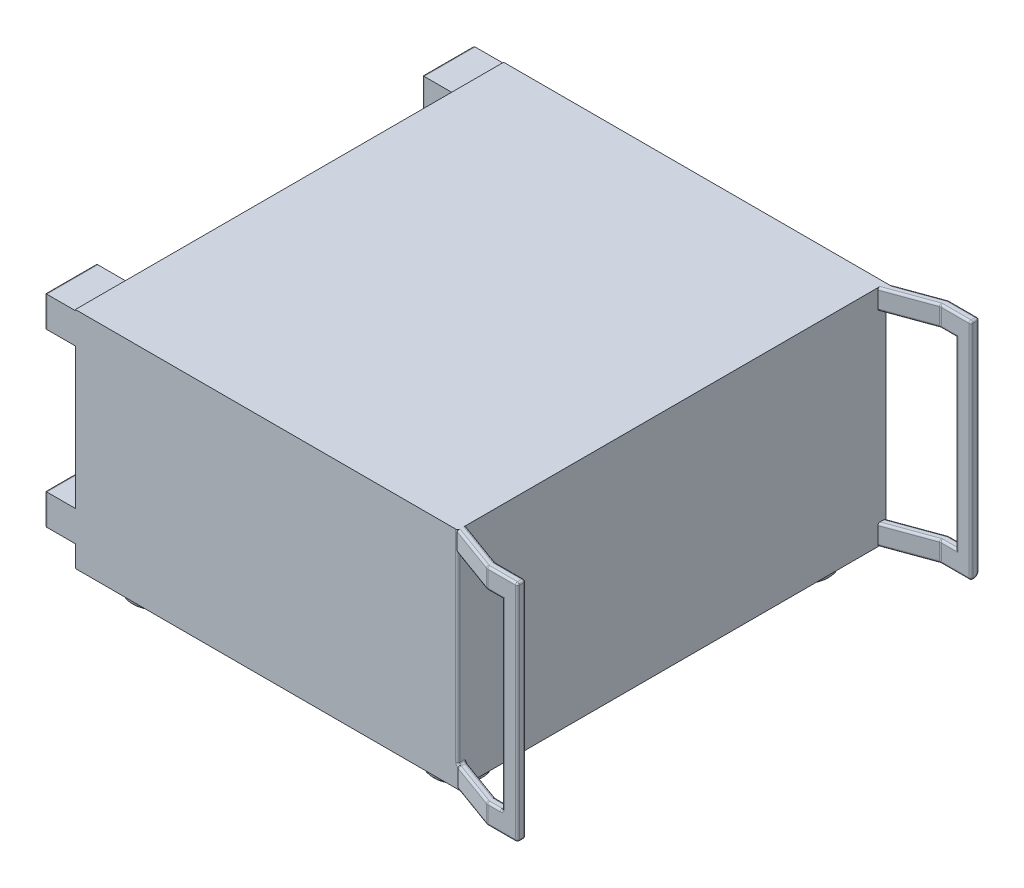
SolidWorks part; units mm, degrees
ref_plane "Front Plane" through (0, 0, 0) normal (0, 0, 1) x (1, 0, 0)
ref_plane "Top Plane" through (0, 0, 0) normal (0, 1, 0) x (1, 0, 0)
ref_plane "Right Plane" through (0, 0, 0) normal (1, 0, 0) x (0, 0, -1)
sketch "Sketch1" plane through (0, 0, 0) normal (0, 1, 0) x (1, 0, 0)
  line L1 (-187.5, -210) -> (187.5, -210)
  line L2 (-187.5, -210) -> (-187.5, 210)
  line L3 (-187.5, 210) -> (187.5, 210)
  line L4 (187.5, -210) -> (187.5, 210)
  line L5 (-187.5, -210) -> (187.5, 210) construction
  line L6 (-187.5, 210) -> (187.5, -210) construction
  point P0 (0, 0)
  dimension "D1" = 375
  dimension "D2" = 420
extrude "Boss-Extrude1" add sketch "Sketch1" along normal blind 220
sketch "Sketch8" plane through (0, 0, 0) normal (0, -1, 0) x (1, 0, 0)
  line L0 (-187.5, 210) -> (187.5, 210) construction
  line L2 (-187.5, -210) -> (-187.5, 210) construction
  circle A0 centre (-147.5, 170) radius 25
  dimension "D1" = 50
  dimension "D3" = 40
  dimension "D2" = 40
extrude "Boss-Extrude3" add sketch "Sketch8" along normal blind 20
mirror "Mirror3" about plane through (0, 0, 0) normal (1, 0, 0) of "Boss-Extrude3"
mirror "Mirror4" about plane through (0, 0, 0) normal (0, 0, 1) of "Mirror3", "Boss-Extrude3"
sketch "Sketch9" plane through (0, 220, 0) normal (0, 1, 0) x (1, 0, 0)
  line L0 (187.5, 210) -> (232.5, 226.3787)
  line L1 (232.5, 226.3787) -> (262.5, 226.3787)
  line L2 (262.5, 226.3787) -> (262.5, 218.3787)
  line L3 (262.5, 218.3787) -> (232.5, 218.3787)
  line L4 (232.5, 218.3787) -> (187.5, 202)
  line L5 (187.5, -210) -> (187.5, 210) construction
  line L6 (187.5, 202) -> (187.5, 210)
  line L7 (187.5, 210) -> (-187.5, 210) construction
  dimension "D1" = 45
  dimension "D2" = 30
  dimension "D3" = 8
  dimension "D4" = 160
extrude "Boss-Extrude4" add sketch "Sketch9" against normal blind 220
mirror "Mirror8" about plane through (0, 0, 0) normal (0, 0, 1) of "Boss-Extrude4"
sketch "Sketch11" plane through (0, 0, -210) normal (0, 0, -1) x (-1, 0, 0)
  line L0 (-187.5, 200) -> (-247.5, 200)
  line L1 (-187.5, 220) -> (-187.5, 0) construction
  line L2 (-247.5, 200) -> (-247.5, 20)
  line L3 (-247.5, 20) -> (-187.5, 20)
  line L4 (-187.5, 20) -> (-187.5, 200)
  line L5 (-232.5, 220) -> (-187.5, 220) construction
  line L6 (-232.5, 0) -> (-187.5, 0) construction
  line L7 (-262.5, 0) -> (-262.5, 220) construction
  dimension "D1" = 20
  dimension "D2" = 20
  dimension "D3" = 15
extrude "Cut-Extrude2" cut sketch "Sketch11" against normal through all both and the other way through all
fillet "Fillet5" radius 2 14 edges at (210, 220, 218.1893) (210, 0, 218.1893) (247.5, 0, 226.3787) (247.5, 220, 226.3787) (262.5, 110, 226.3787) (262.5, 220, 222.3787) (262.5, 0, 222.3787) (210, 220, 210.1893) (210, 0, 210.1893) (247.5, 220, 218.3787) (247.5, 0, 218.3787) (262.5, 110, 218.3787) (247.5, 20, 222.3787) (187.5, 20, 206)
fillet "Fillet6" radius 2 34 edges at (211, 20, 210.5533) (239, 20, 218.3787) (247.5, 111, 218.3787) (187.5, 111, 210) (188.0858, 20.5858, 210.2132) (246.9142, 20.5858, 226.3787) (188.0858, 20.5858, 202.2132) (246.9142, 20.5858, 218.3787) (210, 200, -218.1893) (210, 220, -218.1893) (210, 20, -218.1893) (210, 0, -218.1893) (210, 200, -210.1893) (210, 220, -210.1893) (210, 20, -210.1893) (210, 0, -210.1893) (247.5, 0, -218.3787) (247.5, 220, -218.3787) (262.5, 220, -222.3787) (262.5, 0, -222.3787) (247.5, 220, -226.3787) (262.5, 110, -226.3787) (262.5, 110, -218.3787) (240, 20, -226.3787) (240, 200, -226.3787) (247.5, 110, -226.3787) (240, 200, -218.3787) (247.5, 110, -218.3787) (240, 20, -218.3787) (210, 200, 218.1893) (211, 20, 218.5533) (239, 20, 226.3787) (247.5, 111, 226.3787) (240, 200, 226.3787)
sketch "Sketch12" plane through (-187.5, 0, 0) normal (-1, 0, 0) x (0, 0, 1)
  line L0 (-210, 220) -> (-210, 218) construction
  line L1 (-210, 219) -> (-160, 219)
  line L2 (-210, 219) -> (-210, 189)
  line L3 (-210, 189) -> (-160, 189)
  line L4 (-160, 219) -> (-160, 189)
  dimension "D1" = 50
  dimension "D2" = 30
extrude "Boss-Extrude5" add sketch "Sketch12" along normal blind 30
fillet "Fillet7" radius 2 4 edges at (-217.5, 189, -185) (-217.5, 204, -210) (-217.5, 219, -185) (-217.5, 204, -160)
ref_plane "Plane3" through (0, 120, 0) normal (0, 1, 0) x (1, 0, 0)
mirror "Mirror9" about plane through (0, 120, 0) normal (0, 1, 0) of "Fillet7", "Boss-Extrude5"
mirror "Mirror12" about plane through (0, 0, 0) normal (0, 0, 1) of "Mirror9", "Boss-Extrude5", "Fillet7"
fillet "Fillet10" radius 5 25 edges at (232.6033, 219.4142, -225.7929) (232.6033, 200.5858, -225.7929) (232.6033, 19.4142, -225.7929) (261.9142, 0.5858, -225.7929) (232.6033, 19.4142, 225.7929) (232.6033, 0.5858, 225.7929) (232.6033, 219.4142, 225.7929) (232.6033, 200.5858, 225.7929) (232.3967, 0.5858, 218.9644) (232.3967, 19.4142, 218.9644) (232.3967, 219.4142, 218.9644) (232.3967, 0.5858, -218.9644) (232.3967, 19.4142, -218.9644) (232.3967, 200.5858, -218.9644) (232.3967, 219.4142, -218.9644) (249.4238, 0, -226.3787) (234.2127, 0.5858, -226.3787) (232.5, 210, 226.3787) (232.5, 10, 226.3787) (232.5, 10, 218.3787) (232.5, 209, 218.3787) (232.5, 10, -218.3787) (232.5, 210, -218.3787) (232.5, 10, -226.3787) (232.5, 210, -226.3787)
fillet "Fillet11" radius 5 4 edges at (-147.5, -20, -145) (-147.5, -20, 145) (147.5, -20, -145) (147.5, -20, 145)
sketch "Sketch13" plane through (187.5, 0, 0) normal (1, 0, 0) x (0, 0, -1)
  line L0 (-91.6709, 213.811) -> (273.5778, 213.811) construction
